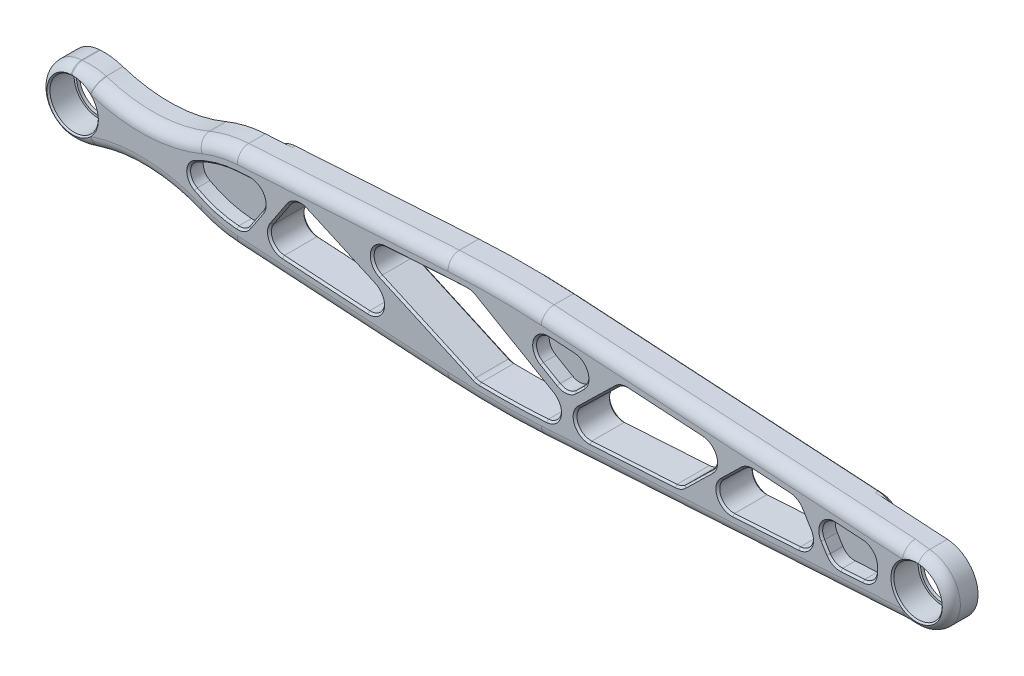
SolidWorks part; units mm, degrees
ref_plane "Front Plane" through (0, 0, 0) normal (0, 0, 1) x (1, 0, 0)
ref_plane "Top Plane" through (0, 0, 0) normal (0, 1, 0) x (1, 0, 0)
ref_plane "Right Plane" through (0, 0, 0) normal (1, 0, 0) x (0, 0, -1)
sketch "Sketch1" plane through (0, 0, 0) normal (0, 0, 1) x (1, 0, 0)
  line L0 (-23.9112, 0) -> (110.617, 0) construction
  line L1 (110.617, 20.0302) -> (110.617, 0) construction
  line L2 (221.7573, 8.5565) -> (123.0221, 14.5954)
  line L3 (-0.5233, 8.5565) -> (-0.3202, 8.5689)
  line L4 (-0.5233, -8.5565) -> (-0.3202, -8.5689)
  line L5 (221.7573, -8.5565) -> (123.0221, -14.5954)
  line L6 (42.9818, 11.2174) -> (98.2119, 14.5954)
  line L7 (42.9818, -11.2174) -> (98.2119, -14.5954)
  arc A0 (-0.5233, 8.5565) -> (-0.5233, -8.5565) centre (0, 0) ccw
  arc A1 (221.7573, 8.5565) -> (221.7573, -8.5565) centre (221.234, 0) cw
  arc A2 (98.2119, 14.5954) -> (123.0221, 14.5954) centre (110.617, -188.2256) cw
  arc A3 (98.2119, -14.5954) -> (123.0221, -14.5954) centre (110.617, 188.2256) ccw
  arc A4 (5.6289, 7.7972) -> (32.6948, 8.8286) centre (17.78, 44.577) ccw
  arc A5 (5.6289, 7.7972) -> (-0.3202, 8.5689) centre (0.649, -7.2765) ccw
  arc A6 (32.6948, 8.8286) -> (42.9818, 11.2174) centre (44.9201, -20.4734) cw
  arc A7 (42.9818, -11.2174) -> (32.6948, -8.8286) centre (44.9201, 20.4734) cw
  arc A8 (5.6289, -7.7972) -> (32.6948, -8.8286) centre (17.78, -44.577) cw
  arc A9 (5.6289, -7.7972) -> (-0.3202, -8.5689) centre (0.649, 7.2765) cw
  point P13 (110.617, 15.3541)
  point P17 (110.617, -15.3541)
  point P25 (36.812, 10.84)
  point P26 (36.812, 10.84)
  point P34 (36.812, -10.84)
  dimension "D1" = 17.145
  dimension "D3" = 203.2
  dimension "D4" = 77.47
  dimension "D5" = 110.617
  dimension "D7" = 17.78
  dimension "D9" = 31.75
  dimension "D6" = 5.842
  dimension "D8" = 15.875
  dimension "D2" = 3.5
extrude "Main Body" add sketch "Sketch1" against normal blind 9.525
sketch "Sketch2" plane through (0, 0, 0) normal (0, 0, 1) x (1, 0, 0)
  circle A0 centre (0, 0) radius 6.35
  circle A1 centre (221.234, 0) radius 6.35
  arc A2 (221.7573, -8.5565) -> (221.7573, 8.5565) centre (221.234, 0) ccw construction
  dimension "D1" = 12.7
extrude "R3ZZ .50\" Dia Bearing Bore" cut sketch "Sketch2" against normal blind 6.731
sketch "Sketch8" plane through (0, 0, 0) normal (0, 0, 1) x (1, 0, 0)
  circle A0 centre (0, 0) radius 5.715
  circle A1 centre (221.234, 0) radius 5.715
  dimension "D1" = 11.43
extrude ".450\" dia thru holes" cut sketch "Sketch8" against normal through all
sketch "Sketch4" plane through (0, 0, -9.525) normal (0, 0, -1) x (-1, 0, 0)
  line L0 (-4.2938, -9.2081) -> (-63.1903, 18.2558)
  line L1 (-63.1903, 18.2558) -> (1.2784, 10.0793)
  line L4 (0, 0) -> (-85.4062, 0) construction
  arc A0 (-4.2938, -9.2081) -> (1.2784, 10.0793) centre (0, 0) ccw
  circle A1 centre (-221.234, 0) radius 12.7
  dimension "D2" = 25.4
  dimension "D1" = 25
  dimension "D3" = 18.2558
extrude "Back side Clearance Cut" cut sketch "Sketch4" against normal blind 1.9939
fillet ".25 Fillets" radius 6.35 4 edges at (212.4045, 9.1286, -8.5281) (212.4045, -9.1286, -8.5281) (9.6724, -6.7, -8.5281) (48.8685, 11.5774, -8.5281)
chamfer ".015 x 45 deg Chamfers" distance 0.381 angle 45 2 edges at (227.584, 0, 0) (6.35, 0, 0)
fillet ".125\" Fillets" radius 3.175 10 edges at (37.7383, 10.4537, 0) (70.5969, 12.9064, 0) (110.617, 14.9744, 0) (172.3897, 11.576, 0) (172.3897, -11.576, 0) (110.617, -14.9744, 0) (70.5969, -12.9064, 0) (37.7383, -10.4537, 0) (19.255, -5.8701, 0) (19.255, 5.8701, 0)
ref_plane "Plane1" through (0, 0, -1.397) normal (0, 0, 1) x (1, 0, 0)
sketch "Sketch9" plane through (0, 0, 0) normal (0, 0, 1) x (1, 0, 0)
  line L7 (122.6344, 8.2573) -> (217.3556, 2.4639)
  line L8 (43.3694, 4.8792) -> (98.5996, 8.2573)
  line L9 (130.8763, 7.7532) -> (175.1606, 5.0446)
  line L10 (46.0734, 5.0446) -> (90.3577, 7.7532)
  line L13 (98.5996, 8.2573) -> (98.5996, -8.2573) construction
  line L14 (122.6344, 8.2573) -> (122.6344, -8.2573) construction
  line L15 (217.3556, -2.4639) -> (122.6344, -8.2573)
  line L16 (98.5996, -8.2573) -> (43.3694, -4.8792)
  line L17 (175.1606, -5.0446) -> (130.8763, -7.7532)
  line L18 (90.3577, -7.7532) -> (46.0734, -5.0446)
  arc A0 (46.0734, 5.0446) -> (46.0734, -5.0446) centre (46.3819, 0) ccw
  arc A1 (175.1606, -5.0446) -> (175.1606, 5.0446) centre (174.8521, 0) ccw
  arc A5 (122.6344, 8.2573) -> (98.5996, 8.2573) centre (110.617, -188.2256) ccw
  arc A8 (90.3577, -7.7532) -> (90.3577, 7.7532) centre (90.8319, 0) ccw
  arc A9 (98.5996, -8.2573) -> (122.6344, -8.2573) centre (110.617, 188.2256) ccw
  arc A11 (130.8763, 7.7532) -> (130.8763, -7.7532) centre (130.4021, 0) ccw
  dimension "D1" = 6.35
  dimension "D3" = 44.45
  dimension "D2" = 6.35
extrude "Thru Pockets" [suppressed] cut sketch "Sketch9" against normal through all
fillet ".06\" Fillets" [suppressed] radius 1.524
sketch "Sketch10" plane through (0, 0, 0) normal (0, 0, 1) x (1, 0, 0)
  line L0 (58.4481, 7.0739) -> (82.3795, 8.5376) construction
  line L1 (98.4058, 11.4263) -> (43.1756, 8.0483) construction
  line L2 (98.5221, 9.5249) -> (43.2919, 6.1469)
  line L3 (43.2919, 6.1469) -> (46.342, 6.3334)
  line L4 (46.0832, -4.6443) -> (49.6103, 0.6564)
  line L5 (43.2919, -6.1469) -> (98.5221, -9.5249)
  line L6 (52.1973, -1.1871) -> (56.655, 5.5122)
  line L7 (48.7265, -6.4031) -> (52.2536, -1.1024) construction
  line L10 (43.2919, -6.1469) -> (98.5221, -9.5249)
  line L11 (55.019, -6.8641) -> (77.371, -8.2312)
  line L12 (61.2033, 6.8205) -> (79.0975, -1.246)
  arc A2 (43.2919, 6.1469) -> (34.6508, 4.1403) centre (44.9201, -20.4734) ccw
  arc A3 (43.2919, 6.1469) -> (32.156, 2.9439) centre (44.9201, -20.4734) ccw
  arc A4 (32.156, 2.9439) -> (32.156, -2.9439) centre (33.7607, 0) ccw
  arc A5 (34.6508, -4.1403) -> (43.2919, -6.1469) centre (44.9201, 20.4734) ccw
  arc A6 (32.156, -2.9439) -> (43.0578, -6.1315) centre (44.9201, 20.4734) ccw
  arc A7 (43.0578, -6.1315) -> (46.0832, -4.6443) centre (43.2919, -2.7869) ccw
  arc A8 (49.6103, 0.6564) -> (46.342, 6.3334) centre (46.5652, 2.6826) ccw
  arc A9 (55.019, -6.8641) -> (52.1973, -1.1871) centre (55.2423, -3.2134) cw
  arc A10 (56.655, 5.5122) -> (61.2033, 6.8205) centre (59.7001, 3.486) cw
  arc A11 (79.0975, -1.246) -> (77.371, -8.2312) centre (77.5943, -4.5805) cw
  dimension "D3" = 6.7056
  dimension "D4" = 6.7056
  dimension "D5" = 3.6576
  dimension "D9" = 3.6576
  dimension "D10" = 22.352
  dimension "D11" = 1.905
  dimension "D12" = 11.9504
  dimension "D7" = 3.175
  dimension "D1" = 1.905
  dimension "D2" = 1.905
  dimension "D8" = 1.905
extrude "Extrude1" cut sketch "Sketch10" against normal blind 3.81
sketch "Sketch11" plane through (0, 0, 0) normal (0, 0, 1) x (1, 0, 0)
  line L0 (80.6734, 1.5263) -> (105.2044, -9.532)
  line L6 (79.0975, -1.246) -> (61.2033, 6.8205) construction
  line L7 (98.5221, 9.5249) -> (43.2919, 6.1469)
  line L8 (98.5221, 9.5249) -> (81.9533, 8.5115)
  line L9 (125.8162, -2.6141) -> (105.3492, 9.2701)
  line L11 (132.8046, -2.4677) -> (142.627, 7.1056)
  line L16 (217.4331, 3.7315) -> (122.7119, 9.5249)
  line L17 (165.1155, 6.9314) -> (145.4032, 8.137)
  line L19 (122.7119, -9.5249) -> (217.4331, -3.7315)
  line L20 (135.5807, -8.7378) -> (157.9327, -7.3707)
  line L21 (160.2623, -6.3392) -> (167.4451, 0.6613)
  arc A0 (103.3789, 9.7622) -> (105.3492, 9.2701) centre (103.5126, 6.107) cw
  arc A4 (125.8162, -2.6141) -> (124.2309, -9.4261) centre (123.9796, -5.7772) cw
  arc A5 (122.7119, 9.5249) -> (98.5221, 9.5249) centre (110.617, -188.2256) ccw
  arc A6 (103.3789, 9.7622) -> (98.5221, 9.5249) centre (110.617, -188.2256) ccw
  arc A8 (105.2044, -9.532) -> (106.634, -9.8544) centre (106.7076, -6.1975) ccw
  arc A9 (80.6734, 1.5263) -> (81.9533, 8.5115) centre (82.1766, 4.8607) cw
  arc A12 (98.5221, -9.5249) -> (122.7119, -9.5249) centre (110.617, 188.2256) ccw
  arc A14 (145.4032, 8.137) -> (142.627, 7.1056) centre (145.1799, 4.4863) ccw
  arc A15 (98.5221, -9.5249) -> (122.7119, -9.5249) centre (110.617, 188.2256) ccw
  arc A16 (106.634, -9.8544) -> (124.2309, -9.4261) centre (110.617, 188.2256) ccw
  arc A17 (167.4451, 0.6613) -> (165.1155, 6.9314) centre (164.8922, 3.2806) ccw
  arc A18 (160.2623, -6.3392) -> (157.9327, -7.3707) centre (157.7094, -3.7199) cw
  arc A19 (132.8046, -2.4677) -> (135.5807, -8.7378) centre (135.3574, -5.087) ccw
  dimension "D5" = 3.6576
  dimension "D12" = 3.6576
  dimension "D4" = 3.6576
  dimension "D3" = 3.175
  dimension "D6" = 17.272
  dimension "D7" = 21.336
  dimension "D11" = 11.3779
  dimension "D13" = 22.352
  dimension "D14" = 13.716
  dimension "D2" = 1.905
  dimension "D8" = 1.905
  dimension "D9" = 1.905
  dimension "D10" = 1.905
extrude "Extrude2" cut sketch "Sketch11" against normal through all
sketch "Sketch12" plane through (0, 0, 0) normal (0, 0, 1) x (1, 0, 0)
  line L0 (170.2219, -0.1792) -> (175.6254, 5.0873)
  line L1 (160.2623, -6.3392) -> (167.4451, 0.6613) construction
  line L6 (190.9496, 3.7877) -> (193.1661, 0.1679)
  line L10 (196.6148, -0.6003) -> (198.0982, -3.0229)
  line L11 (217.4331, 3.7315) -> (122.7119, 9.5249)
  line L12 (207.1231, 4.3621) -> (199.8645, 4.806)
  line L15 (201.3479, -4.7153) -> (207.1231, -4.3621)
  line L16 (122.7119, -9.5249) -> (217.4331, -3.7315)
  line L17 (172.9981, -6.4493) -> (190.2701, -5.3929)
  line L18 (188.0536, 5.5284) -> (178.4016, 6.1188)
  arc A0 (175.6254, 5.0873) -> (178.4016, 6.1188) centre (178.1783, 2.468) cw
  arc A1 (170.2219, -0.1792) -> (172.9981, -6.4493) centre (172.7748, -2.7985) ccw
  arc A2 (193.1661, 0.1679) -> (190.2701, -5.3929) centre (190.0468, -1.7421) cw
  arc A3 (190.9496, 3.7877) -> (188.0536, 5.5284) centre (187.8303, 1.8776) ccw
  arc A5 (210.4563, 0.6113) -> (207.1231, 4.3621) centre (206.906, 0.8127) ccw
  circle A6 centre (221.234, 0) radius 10.795
  arc A7 (210.4563, 0.6113) -> (210.4563, -0.6113) centre (221.234, 0) ccw
  arc A8 (210.4563, -0.6113) -> (207.1231, -4.3621) centre (206.906, -0.8127) cw
  arc A9 (201.3479, -4.7153) -> (198.0982, -3.0229) centre (201.1308, -1.1659) cw
  arc A10 (199.8645, 4.806) -> (196.6148, -0.6003) centre (199.6474, 1.2567) ccw
  dimension "D4" = 3.6576
  dimension "D11" = 3.556
  dimension "D1" = 2.54
  dimension "D5" = 9.652
  dimension "D6" = 17.272
  dimension "D8" = 2.54
  dimension "D7" = 1.905
  dimension "D9" = 1.905
  dimension "D10" = 4.445
extrude "Extrude3" cut sketch "Sketch12" against normal up to surface (3.81 mm away)
sketch "Sketch13" plane through (0, 0, -3.81) normal (0, 0, 1) x (1, 0, 0)
  line L3 (55.019, -6.8641) -> (77.371, -8.2312)
  line L4 (79.0975, -1.246) -> (61.2033, 6.8205)
  line L5 (56.655, 5.5122) -> (52.1973, -1.1871)
  line L6 (55.019, -6.8641) -> (77.371, -8.2312)
  line L7 (79.0975, -1.246) -> (61.2033, 6.8205)
  line L8 (56.655, 5.5122) -> (52.1973, -1.1871)
  line L10 (175.6254, 5.0873) -> (170.2219, -0.1792)
  line L11 (172.9981, -6.4493) -> (190.2701, -5.3929)
  line L12 (193.1661, 0.1679) -> (190.9496, 3.7877)
  line L13 (188.0536, 5.5284) -> (178.4016, 6.1188)
  line L14 (175.6254, 5.0873) -> (170.2219, -0.1792)
  line L15 (172.9981, -6.4493) -> (190.2701, -5.3929)
  line L16 (193.1661, 0.1679) -> (190.9496, 3.7877)
  line L17 (188.0536, 5.5284) -> (178.4016, 6.1188)
  arc A3 (52.1973, -1.1871) -> (55.019, -6.8641) centre (55.2423, -3.2134) ccw
  arc A4 (77.371, -8.2312) -> (79.0975, -1.246) centre (77.5943, -4.5805) ccw
  arc A5 (61.2033, 6.8205) -> (56.655, 5.5122) centre (59.7001, 3.486) ccw
  arc A6 (52.1973, -1.1871) -> (55.019, -6.8641) centre (55.2423, -3.2134) ccw
  arc A7 (77.371, -8.2312) -> (79.0975, -1.246) centre (77.5943, -4.5805) ccw
  arc A8 (61.2033, 6.8205) -> (56.655, 5.5122) centre (59.7001, 3.486) ccw
  arc A10 (178.4016, 6.1188) -> (175.6254, 5.0873) centre (178.1783, 2.468) ccw
  arc A11 (170.2219, -0.1792) -> (172.9981, -6.4493) centre (172.7748, -2.7985) ccw
  arc A12 (190.2701, -5.3929) -> (193.1661, 0.1679) centre (190.0468, -1.7421) ccw
  arc A13 (190.9496, 3.7877) -> (188.0536, 5.5284) centre (187.8303, 1.8776) ccw
  arc A14 (178.4016, 6.1188) -> (175.6254, 5.0873) centre (178.1783, 2.468) ccw
  arc A15 (170.2219, -0.1792) -> (172.9981, -6.4493) centre (172.7748, -2.7985) ccw
  arc A16 (190.2701, -5.3929) -> (193.1661, 0.1679) centre (190.0468, -1.7421) ccw
  arc A17 (190.9496, 3.7877) -> (188.0536, 5.5284) centre (187.8303, 1.8776) ccw
  dimension "D1" = 0
  dimension "D2" = 0
extrude "Extrude4" cut sketch "Sketch13" against normal through all
sketch "Sketch14" plane through (0, 0, 0) normal (0, 0, 1) x (1, 0, 0)
  line L2 (125.8162, -2.6141) -> (105.3492, 9.2701) construction
  line L3 (142.627, 7.1056) -> (132.8046, -2.4677) construction
  line L4 (217.4331, 3.7315) -> (122.7119, 9.5249)
  line L5 (131.49, 8.988) -> (124.8723, 9.3928)
  line L8 (127.2769, 0.2091) -> (122.8696, 2.7682)
  line L11 (133.7549, 2.8921) -> (131.5445, 0.7377)
  arc A1 (122.8696, 2.7682) -> (124.8723, 9.3928) centre (124.6552, 5.8434) cw
  arc A2 (131.49, 8.988) -> (133.7549, 2.8921) centre (131.2729, 5.4386) cw
  arc A3 (127.2769, 0.2091) -> (131.5445, 0.7377) centre (129.0625, 3.2843) ccw
  arc A4 (122.7119, 9.5249) -> (98.5221, 9.5249) centre (110.617, -188.2256) ccw
  dimension "D1" = 3.556
  dimension "D3" = 3.175
  dimension "D4" = 3.175
  dimension "D2" = 1.905
extrude "Extrude6" cut sketch "Sketch14" along normal blind 2.54 and the other way up to surface
sketch "Sketch15" plane through (0, 0, -9.525) normal (0, 0, -1) x (-1, 0, 0)
  line L3 (-127.2769, 0.2091) -> (-122.8696, 2.7682)
  line L4 (-133.7549, 2.8921) -> (-131.5445, 0.7377)
  line L5 (-124.8723, 9.3928) -> (-131.49, 8.988)
  line L6 (-127.2769, 0.2091) -> (-122.8696, 2.7682)
  line L7 (-133.7549, 2.8921) -> (-131.5445, 0.7377)
  line L8 (-124.8723, 9.3928) -> (-131.49, 8.988)
  arc A5 (-122.8696, 2.7682) -> (-124.8723, 9.3928) centre (-124.6552, 5.8434) ccw
  arc A6 (-131.5445, 0.7377) -> (-127.2769, 0.2091) centre (-129.0625, 3.2843) ccw
  arc A7 (-131.49, 8.988) -> (-133.7549, 2.8921) centre (-131.2729, 5.4386) ccw
  arc A9 (-122.8696, 2.7682) -> (-124.8723, 9.3928) centre (-124.6552, 5.8434) ccw
  arc A10 (-131.5445, 0.7377) -> (-127.2769, 0.2091) centre (-129.0625, 3.2843) ccw
  arc A11 (-131.49, 8.988) -> (-133.7549, 2.8921) centre (-131.2729, 5.4386) ccw
  dimension "D1" = 0
extrude "Extrude7" cut sketch "Sketch15" against normal blind 3.81
chamfer "Chamfer2" distance 1.27 angle 45 14 edges at (48.8964, 11.4675, -9.525) (39.4588, 7.1896, -9.525) (74.1419, 13.1232, -9.525) (27.4794, -2.6738, -9.525) (110.617, 14.9744, -9.525) (32.1319, -8.5989, -9.525) (162.9474, 12.1535, -9.525) (37.7383, -10.4537, -9.525) (207.4787, 7.2959, -9.525) (70.5969, -12.9064, -9.525) (208.534, 0, -9.525) (110.617, -14.9744, -9.525) (207.4787, -7.2959, -9.525) (162.9474, -12.1535, -9.525)
sketch "Sketch17" plane through (0, 0, -3.81) normal (0, 0, 1) x (1, 0, 0)
  line L0 (46.342, 6.3334) -> (43.2919, 6.1469) construction
  line L1 (46.0832, -4.6443) -> (49.6103, 0.6564) construction
  line L2 (46.342, 6.3334) -> (43.2919, 6.1469)
  line L3 (46.0832, -4.6443) -> (49.6103, 0.6564)
  arc A0 (43.2919, 6.1469) -> (32.156, 2.9439) centre (44.9201, -20.4734) ccw construction
  arc A1 (49.6103, 0.6564) -> (46.342, 6.3334) centre (46.5652, 2.6826) ccw construction
  arc A2 (43.0578, -6.1315) -> (46.0832, -4.6443) centre (43.2919, -2.7869) ccw construction
  arc A3 (32.156, -2.9439) -> (43.0578, -6.1315) centre (44.9201, 20.4734) ccw construction
  arc A4 (32.156, 2.9439) -> (32.156, -2.9439) centre (33.7607, 0) ccw construction
  arc A5 (43.2919, 6.1469) -> (32.156, 2.9439) centre (44.9201, -20.4734) ccw
  arc A6 (49.6103, 0.6564) -> (46.342, 6.3334) centre (46.5652, 2.6826) ccw
  arc A7 (43.0578, -6.1315) -> (46.0832, -4.6443) centre (43.2919, -2.7869) ccw
  arc A8 (32.156, -2.9439) -> (43.0578, -6.1315) centre (44.9201, 20.4734) ccw
  arc A9 (32.156, 2.9439) -> (32.156, -2.9439) centre (33.7607, 0) ccw
sketch "Sketch20" plane through (0, 0, 0) normal (0, 0, 1) x (1, 0, 0)
  line L0 (98.2119, -14.5954) -> (42.9818, -11.2174) construction
  line L1 (217.7432, -8.802) -> (123.0221, -14.5954) construction
  line L2 (217.7432, -8.802) -> (221.7573, -8.5565) construction
  line L3 (221.7573, 8.5565) -> (217.7432, 8.802) construction
  line L4 (123.0221, 14.5954) -> (217.7432, 8.802) construction
  line L5 (42.9818, 11.2174) -> (98.2119, 14.5954) construction
  line L6 (-0.3202, 8.5689) -> (-0.5233, 8.5565) construction
  line L7 (-0.5233, -8.5565) -> (-0.3202, -8.5689) construction
  line L8 (98.2119, -14.5954) -> (42.9818, -11.2174)
  line L9 (217.7432, -8.802) -> (123.0221, -14.5954)
  line L10 (217.7432, -8.802) -> (221.7573, -8.5565)
  line L11 (221.7573, 8.5565) -> (217.7432, 8.802)
  line L12 (123.0221, 14.5954) -> (217.7432, 8.802)
  line L13 (42.9818, 11.2174) -> (98.2119, 14.5954)
  line L14 (-0.3202, 8.5689) -> (-0.5233, 8.5565)
  line L15 (-0.5233, -8.5565) -> (-0.3202, -8.5689)
  arc A0 (98.2119, -14.5954) -> (123.0221, -14.5954) centre (110.617, 188.2256) ccw construction
  arc A1 (221.7573, -8.5565) -> (221.7573, 8.5565) centre (221.234, 0) ccw construction
  arc A2 (123.0221, 14.5954) -> (98.2119, 14.5954) centre (110.617, -188.2256) ccw construction
  arc A3 (42.9818, 11.2174) -> (32.6948, 8.8286) centre (44.9201, -20.4734) ccw construction
  arc A4 (5.7713, 7.7505) -> (32.6948, 8.8286) centre (17.78, 44.577) ccw construction
  arc A5 (5.6289, 7.7972) -> (5.7713, 7.7505) centre (17.78, 44.577) ccw construction
  arc A6 (5.6289, 7.7972) -> (-0.3202, 8.5689) centre (0.649, -7.2765) ccw construction
  arc A7 (-0.5233, 8.5565) -> (-0.5233, -8.5565) centre (0, 0) ccw construction
  arc A8 (-0.3202, -8.5689) -> (5.6289, -7.7972) centre (0.649, 7.2765) ccw construction
  arc A9 (5.7713, -7.7505) -> (5.6289, -7.7972) centre (17.78, -44.577) ccw construction
  arc A10 (32.6948, -8.8286) -> (5.7713, -7.7505) centre (17.78, -44.577) ccw construction
  arc A11 (32.6948, -8.8286) -> (42.9818, -11.2174) centre (44.9201, 20.4734) ccw construction
  arc A12 (98.2119, -14.5954) -> (123.0221, -14.5954) centre (110.617, 188.2256) ccw
  arc A13 (221.7573, -8.5565) -> (221.7573, 8.5565) centre (221.234, 0) ccw
  arc A14 (123.0221, 14.5954) -> (98.2119, 14.5954) centre (110.617, -188.2256) ccw
  arc A15 (42.9818, 11.2174) -> (32.6948, 8.8286) centre (44.9201, -20.4734) ccw
  arc A16 (5.7713, 7.7505) -> (32.6948, 8.8286) centre (17.78, 44.577) ccw
  arc A17 (5.6289, 7.7972) -> (5.7713, 7.7505) centre (17.78, 44.577) ccw
  arc A18 (5.6289, 7.7972) -> (-0.3202, 8.5689) centre (0.649, -7.2765) ccw
  arc A19 (-0.5233, 8.5565) -> (-0.5233, -8.5565) centre (0, 0) ccw
  arc A20 (-0.3202, -8.5689) -> (5.6289, -7.7972) centre (0.649, 7.2765) ccw
  arc A21 (5.7713, -7.7505) -> (5.6289, -7.7972) centre (17.78, -44.577) ccw
  arc A22 (32.6948, -8.8286) -> (5.7713, -7.7505) centre (17.78, -44.577) ccw
  arc A23 (32.6948, -8.8286) -> (42.9818, -11.2174) centre (44.9201, 20.4734) ccw
sketch "Sketch21" plane through (0, 0, 0) normal (0, 0, 1) x (1, 0, 0)
  line L0 (98.2119, -14.5954) -> (42.9818, -11.2174) construction
  line L1 (217.7432, -8.802) -> (123.0221, -14.5954) construction
  line L2 (217.7432, -8.802) -> (221.7573, -8.5565) construction
  line L3 (221.7573, 8.5565) -> (217.7432, 8.802) construction
  line L4 (123.0221, 14.5954) -> (217.7432, 8.802) construction
  line L5 (42.9818, 11.2174) -> (98.2119, 14.5954) construction
  line L6 (-0.3202, 8.5689) -> (-0.5233, 8.5565) construction
  line L7 (-0.5233, -8.5565) -> (-0.3202, -8.5689) construction
  line L8 (98.2119, -14.5954) -> (42.9818, -11.2174)
  line L9 (217.7432, -8.802) -> (123.0221, -14.5954)
  line L10 (217.7432, -8.802) -> (221.7573, -8.5565)
  line L11 (221.7573, 8.5565) -> (217.7432, 8.802)
  line L12 (123.0221, 14.5954) -> (217.7432, 8.802)
  line L13 (42.9818, 11.2174) -> (98.2119, 14.5954)
  line L14 (-0.3202, 8.5689) -> (-0.5233, 8.5565)
  line L15 (-0.5233, -8.5565) -> (-0.3202, -8.5689)
  arc A0 (32.6948, -8.8286) -> (5.7713, -7.7505) centre (17.78, -44.577) ccw construction
  arc A1 (32.6948, -8.8286) -> (42.9818, -11.2174) centre (44.9201, 20.4734) ccw construction
  arc A2 (98.2119, -14.5954) -> (123.0221, -14.5954) centre (110.617, 188.2256) ccw construction
  arc A3 (221.7573, -8.5565) -> (221.7573, 8.5565) centre (221.234, 0) ccw construction
  arc A4 (123.0221, 14.5954) -> (98.2119, 14.5954) centre (110.617, -188.2256) ccw construction
  arc A5 (42.9818, 11.2174) -> (32.6948, 8.8286) centre (44.9201, -20.4734) ccw construction
  arc A6 (5.7713, 7.7505) -> (32.6948, 8.8286) centre (17.78, 44.577) ccw construction
  arc A7 (5.6289, 7.7972) -> (5.7713, 7.7505) centre (17.78, 44.577) ccw construction
  arc A8 (5.6289, 7.7972) -> (-0.3202, 8.5689) centre (0.649, -7.2765) ccw construction
  arc A9 (-0.5233, 8.5565) -> (-0.5233, -8.5565) centre (0, 0) ccw construction
  arc A10 (-0.3202, -8.5689) -> (5.6289, -7.7972) centre (0.649, 7.2765) ccw construction
  arc A11 (5.7713, -7.7505) -> (5.6289, -7.7972) centre (17.78, -44.577) ccw construction
  arc A12 (32.6948, -8.8286) -> (5.7713, -7.7505) centre (17.78, -44.577) ccw
  arc A13 (32.6948, -8.8286) -> (42.9818, -11.2174) centre (44.9201, 20.4734) ccw
  arc A14 (98.2119, -14.5954) -> (123.0221, -14.5954) centre (110.617, 188.2256) ccw
  arc A15 (221.7573, -8.5565) -> (221.7573, 8.5565) centre (221.234, 0) ccw
  arc A16 (123.0221, 14.5954) -> (98.2119, 14.5954) centre (110.617, -188.2256) ccw
  arc A17 (42.9818, 11.2174) -> (32.6948, 8.8286) centre (44.9201, -20.4734) ccw
  arc A18 (5.7713, 7.7505) -> (32.6948, 8.8286) centre (17.78, 44.577) ccw
  arc A19 (5.6289, 7.7972) -> (5.7713, 7.7505) centre (17.78, 44.577) ccw
  arc A20 (5.6289, 7.7972) -> (-0.3202, 8.5689) centre (0.649, -7.2765) ccw
  arc A21 (-0.5233, 8.5565) -> (-0.5233, -8.5565) centre (0, 0) ccw
  arc A22 (-0.3202, -8.5689) -> (5.6289, -7.7972) centre (0.649, 7.2765) ccw
  arc A23 (5.7713, -7.7505) -> (5.6289, -7.7972) centre (17.78, -44.577) ccw
ref_plane "Plane2" through (0, 0, -3.175) normal (0, 0, 1) x (1, 0, 0)
sketch "Sketch22" plane through (0, 0, -3.175) normal (0, 0, 1) x (1, 0, 0)
  line L0 (98.2119, -14.5954) -> (42.9818, -11.2174) construction
  line L1 (217.7432, -8.802) -> (123.0221, -14.5954) construction
  line L2 (217.7432, -8.802) -> (221.7573, -8.5565) construction
  line L3 (221.7573, 8.5565) -> (217.7432, 8.802) construction
  line L4 (123.0221, 14.5954) -> (217.7432, 8.802) construction
  line L5 (42.9818, 11.2174) -> (98.2119, 14.5954) construction
  line L6 (-0.3202, 8.5689) -> (-0.5233, 8.5565) construction
  line L7 (-0.5233, -8.5565) -> (-0.3202, -8.5689) construction
  line L8 (98.2119, -14.5954) -> (42.9818, -11.2174)
  line L9 (217.7432, -8.802) -> (123.0221, -14.5954)
  line L10 (217.7432, -8.802) -> (221.7573, -8.5565)
  line L11 (221.7573, 8.5565) -> (217.7432, 8.802)
  line L12 (123.0221, 14.5954) -> (217.7432, 8.802)
  line L13 (42.9818, 11.2174) -> (98.2119, 14.5954)
  line L14 (-0.3202, 8.5689) -> (-0.5233, 8.5565)
  line L15 (-0.5233, -8.5565) -> (-0.3202, -8.5689)
  arc A0 (32.6948, -8.8286) -> (42.9818, -11.2174) centre (44.9201, 20.4734) ccw construction
  arc A1 (98.2119, -14.5954) -> (123.0221, -14.5954) centre (110.617, 188.2256) ccw construction
  arc A2 (221.7573, -8.5565) -> (221.7573, 8.5565) centre (221.234, 0) ccw construction
  arc A3 (123.0221, 14.5954) -> (98.2119, 14.5954) centre (110.617, -188.2256) ccw construction
  arc A4 (42.9818, 11.2174) -> (32.6948, 8.8286) centre (44.9201, -20.4734) ccw construction
  arc A5 (5.7713, 7.7505) -> (32.6948, 8.8286) centre (17.78, 44.577) ccw construction
  arc A6 (5.6289, 7.7972) -> (5.7713, 7.7505) centre (17.78, 44.577) ccw construction
  arc A7 (5.6289, 7.7972) -> (-0.3202, 8.5689) centre (0.649, -7.2765) ccw construction
  arc A8 (-0.5233, 8.5565) -> (-0.5233, -8.5565) centre (0, 0) ccw construction
  arc A9 (-0.3202, -8.5689) -> (5.6289, -7.7972) centre (0.649, 7.2765) ccw construction
  arc A10 (5.7713, -7.7505) -> (5.6289, -7.7972) centre (17.78, -44.577) ccw construction
  arc A11 (32.6948, -8.8286) -> (5.7713, -7.7505) centre (17.78, -44.577) ccw construction
  arc A12 (32.6948, -8.8286) -> (42.9818, -11.2174) centre (44.9201, 20.4734) ccw
  arc A13 (98.2119, -14.5954) -> (123.0221, -14.5954) centre (110.617, 188.2256) ccw
  arc A14 (221.7573, -8.5565) -> (221.7573, 8.5565) centre (221.234, 0) ccw
  arc A15 (123.0221, 14.5954) -> (98.2119, 14.5954) centre (110.617, -188.2256) ccw
  arc A16 (42.9818, 11.2174) -> (32.6948, 8.8286) centre (44.9201, -20.4734) ccw
  arc A17 (5.7713, 7.7505) -> (32.6948, 8.8286) centre (17.78, 44.577) ccw
  arc A18 (5.6289, 7.7972) -> (5.7713, 7.7505) centre (17.78, 44.577) ccw
  arc A19 (5.6289, 7.7972) -> (-0.3202, 8.5689) centre (0.649, -7.2765) ccw
  arc A20 (-0.5233, 8.5565) -> (-0.5233, -8.5565) centre (0, 0) ccw
  arc A21 (-0.3202, -8.5689) -> (5.6289, -7.7972) centre (0.649, 7.2765) ccw
  arc A22 (5.7713, -7.7505) -> (5.6289, -7.7972) centre (17.78, -44.577) ccw
  arc A23 (32.6948, -8.8286) -> (5.7713, -7.7505) centre (17.78, -44.577) ccw
sketch "Sketch24" plane through (0, 0, -9.525) normal (0, 0, -1) x (-1, 0, 0)
  line L0 (-42.9818, 11.2174) -> (-98.2119, 14.5954) construction
  line L1 (0.5233, 8.5565) -> (0.3202, 8.5689) construction
  line L2 (0.3202, -8.5689) -> (0.5233, -8.5565) construction
  line L3 (-98.2119, -14.5954) -> (-42.9818, -11.2174) construction
  line L4 (-217.7432, -8.802) -> (-123.0221, -14.5954) construction
  line L5 (-221.7573, -8.5565) -> (-217.7432, -8.802) construction
  line L6 (-217.7432, 8.802) -> (-221.7573, 8.5565) construction
  line L7 (-123.0221, 14.5954) -> (-217.7432, 8.802) construction
  line L8 (-42.9818, 11.2174) -> (-98.2119, 14.5954)
  line L9 (0.5233, 8.5565) -> (0.3202, 8.5689)
  line L10 (0.3202, -8.5689) -> (0.5233, -8.5565)
  line L11 (-98.2119, -14.5954) -> (-42.9818, -11.2174)
  line L12 (-217.7432, -8.802) -> (-123.0221, -14.5954)
  line L13 (-221.7573, -8.5565) -> (-217.7432, -8.802)
  line L14 (-217.7432, 8.802) -> (-221.7573, 8.5565)
  line L15 (-123.0221, 14.5954) -> (-217.7432, 8.802)
  arc A0 (-32.6948, 8.8286) -> (-42.9818, 11.2174) centre (-44.9201, -20.4734) ccw construction
  arc A1 (-32.6948, 8.8286) -> (-5.7713, 7.7505) centre (-17.78, 44.577) ccw construction
  arc A2 (-5.7713, 7.7505) -> (-5.6289, 7.7972) centre (-17.78, 44.577) ccw construction
  arc A3 (0.3202, 8.5689) -> (-5.6289, 7.7972) centre (-0.649, -7.2765) ccw construction
  arc A4 (0.5233, -8.5565) -> (0.5233, 8.5565) centre (0, 0) ccw construction
  arc A5 (-5.6289, -7.7972) -> (0.3202, -8.5689) centre (-0.649, 7.2765) ccw construction
  arc A6 (-5.6289, -7.7972) -> (-5.7713, -7.7505) centre (-17.78, -44.577) ccw construction
  arc A7 (-5.7713, -7.7505) -> (-32.6948, -8.8286) centre (-17.78, -44.577) ccw construction
  arc A8 (-42.9818, -11.2174) -> (-32.6948, -8.8286) centre (-44.9201, 20.4734) ccw construction
  arc A9 (-123.0221, -14.5954) -> (-98.2119, -14.5954) centre (-110.617, 188.2256) ccw construction
  arc A10 (-221.7573, 8.5565) -> (-221.7573, -8.5565) centre (-221.234, 0) ccw construction
  arc A11 (-98.2119, 14.5954) -> (-123.0221, 14.5954) centre (-110.617, -188.2256) ccw construction
  arc A12 (-32.6948, 8.8286) -> (-42.9818, 11.2174) centre (-44.9201, -20.4734) ccw
  arc A13 (-32.6948, 8.8286) -> (-5.7713, 7.7505) centre (-17.78, 44.577) ccw
  arc A14 (-5.7713, 7.7505) -> (-5.6289, 7.7972) centre (-17.78, 44.577) ccw
  arc A15 (0.3202, 8.5689) -> (-5.6289, 7.7972) centre (-0.649, -7.2765) ccw
  arc A16 (0.5233, -8.5565) -> (0.5233, 8.5565) centre (0, 0) ccw
  arc A17 (-5.6289, -7.7972) -> (0.3202, -8.5689) centre (-0.649, 7.2765) ccw
  arc A18 (-5.6289, -7.7972) -> (-5.7713, -7.7505) centre (-17.78, -44.577) ccw
  arc A19 (-5.7713, -7.7505) -> (-32.6948, -8.8286) centre (-17.78, -44.577) ccw
  arc A20 (-42.9818, -11.2174) -> (-32.6948, -8.8286) centre (-44.9201, 20.4734) ccw
  arc A21 (-123.0221, -14.5954) -> (-98.2119, -14.5954) centre (-110.617, 188.2256) ccw
  arc A22 (-221.7573, 8.5565) -> (-221.7573, -8.5565) centre (-221.234, 0) ccw
  arc A23 (-98.2119, 14.5954) -> (-123.0221, 14.5954) centre (-110.617, -188.2256) ccw
sketch "Sketch25" plane through (0, 0, -7.5311) normal (0, 0, -1) x (-1, 0, 0)
  line L0 (-50.0719, 11.651) -> (-42.9818, 11.2174) construction
  line L1 (0.3202, 8.5689) -> (0.5233, 8.5565) construction
  line L2 (0.5233, -8.5565) -> (0.3202, -8.5689) construction
  line L3 (-50.0719, 11.651) -> (-42.9818, 11.2174)
  line L4 (0.3202, 8.5689) -> (0.5233, 8.5565)
  line L5 (0.5233, -8.5565) -> (0.3202, -8.5689)
  line L6 (-47.7759, 11.0679) -> (-31.1416, 3.3113) construction
  line L7 (-47.7759, 11.0679) -> (-31.1416, 3.3113)
  arc A0 (-32.6948, 8.8286) -> (-5.6289, 7.7972) centre (-17.78, 44.577) ccw construction
  arc A1 (-32.6948, 8.8286) -> (-42.9818, 11.2174) centre (-44.9201, -20.4734) ccw construction
  arc A2 (0.3202, 8.5689) -> (-5.6289, 7.7972) centre (-0.649, -7.2765) ccw construction
  arc A3 (0.5233, -8.5565) -> (0.5233, 8.5565) centre (0, 0) ccw construction
  arc A4 (-5.6289, -7.7972) -> (0.3202, -8.5689) centre (-0.649, 7.2765) ccw construction
  arc A5 (-5.6289, -7.7972) -> (-31.5654, -8.378) centre (-17.78, -44.577) ccw construction
  arc A6 (-32.6948, 8.8286) -> (-5.6289, 7.7972) centre (-17.78, 44.577) ccw
  arc A7 (-32.6948, 8.8286) -> (-42.9818, 11.2174) centre (-44.9201, -20.4734) ccw
  arc A8 (0.3202, 8.5689) -> (-5.6289, 7.7972) centre (-0.649, -7.2765) ccw
  arc A9 (0.5233, -8.5565) -> (0.5233, 8.5565) centre (0, 0) ccw
  arc A10 (-5.6289, -7.7972) -> (0.3202, -8.5689) centre (-0.649, 7.2765) ccw
  arc A11 (-5.6289, -7.7972) -> (-31.5654, -8.378) centre (-17.78, -44.577) ccw
  arc A12 (-47.7759, 11.0679) -> (-50.0719, 11.651) centre (-50.4595, 5.3129) ccw construction
  arc A13 (-31.5654, -8.378) -> (-31.1416, 3.3113) centre (-33.8253, -2.4438) ccw construction
  arc A14 (-47.7759, 11.0679) -> (-50.0719, 11.651) centre (-50.4595, 5.3129) ccw
  arc A15 (-31.5654, -8.378) -> (-31.1416, 3.3113) centre (-33.8253, -2.4438) ccw
ref_plane "Plane3" through (0, 0, -6.2611) normal (0, 0, -1) x (-1, 0, 0)
sketch "Sketch26" plane through (0, 0, -7.5311) normal (0, 0, -1) x (-1, 0, 0)
  text T0 "l" font "BankGothic Md BT" height in points 9
extrude "Cut-Extrude1" cut sketch "Sketch26" against normal blind 0.127
chamfer "Chamfer3" distance 0.508 angle 45 89 edges at (209.5641, -3.1749, 0) (210.439, 0, 0) (204.2355, -4.5387, 0) (209.5641, 3.1749, 0) (199.4883, -4.3199, 0) (203.4938, 4.5841, 0) (197.3565, -1.8116, 0) (196.5997, 3.0887, 0) (189.7147, 5.0125, 0) (183.2276, 5.8236, 0) (192.0578, 1.9778, 0) (176.9045, 5.8966, 0) (193.2908, -3.4315, 0) (172.9237, 2.4541, 0) (181.6341, -5.9211, 0) (169.4303, -4.2793, 0) (168.3208, 4.5545, 0) (155.2593, 7.5342, 0) (163.8537, -2.839, 0) (143.9061, 7.9149, 0) (159.1902, -7.0644, 0) (137.7158, 2.3189, 0) (146.7567, -8.0543, 0) (132.013, -6.5678, 0) (134.6063, 6.6771, 0) (128.1812, 9.1904, 0) (132.6497, 1.8149, 0) (121.2514, 6.8724, 0) (129.4997, -0.2447, 0) (125.0733, 1.4887, 0) (104.3989, 9.6556, 0) (115.5827, 3.328, 0) (100.9498, 9.6584, 0) (127.542, -6.6062, 0) (90.2377, 9.0182, 0) (115.4372, -9.8358, 0) (78.5788, 5.5199, 0) (105.9029, -9.7655, 0) (92.9389, -4.0029, 0) (70.1504, 2.7872, 0) (58.689, 7.0011, 0) (81.1451, -5.458, 0) (54.4261, 2.1625, 0) (66.195, -7.5477, 0) (51.967, -4.8414, 0) (44.8169, 6.2401, 0) (49.7351, 4.5076, 0) (37.5479, 5.1575, 0) (47.8468, -1.9939, 0) (30.4079, 0, 0) (44.771, -5.7958, 0) (37.4352, -5.1248, 0) (51.967, -4.8414, -9.525) (66.195, -7.5477, -9.525) (54.4261, 2.1625, -9.525) (81.1451, -5.458, -9.525) (58.689, 7.0011, -9.525) (70.1504, 2.7872, -9.525) (127.542, -6.6062, -9.525) (115.4372, -9.8358, -9.525) (115.5827, 3.328, -9.525) (105.9029, -9.7655, -9.525) (104.3989, 9.6556, -9.525) (92.9389, -4.0029, -9.525) (100.9498, 9.6584, -9.525) (78.5788, 5.5199, -9.525) (90.2377, 9.0182, -9.525) (129.4997, -0.2447, -9.525) (125.0733, 1.4887, -9.525) (132.6497, 1.8149, -9.525) (121.2514, 6.8724, -9.525) (134.6063, 6.6771, -9.525) (128.1812, 9.1904, -9.525) (146.7567, -8.0543, -9.525) (159.1902, -7.0644, -9.525) (132.013, -6.5678, -9.525) (163.8537, -2.839, -9.525) (137.7158, 2.3189, -9.525) (168.3208, 4.5545, -9.525) (143.9061, 7.9149, -9.525) (155.2593, 7.5342, -9.525) (181.6341, -5.9211, -9.525) (193.2908, -3.4315, -9.525) (169.4303, -4.2793, -9.525) (192.0578, 1.9778, -9.525) (172.9237, 2.4541, -9.525) (189.7147, 5.0125, -9.525) (176.9045, 5.8966, -9.525) (183.2276, 5.8236, -9.525)
